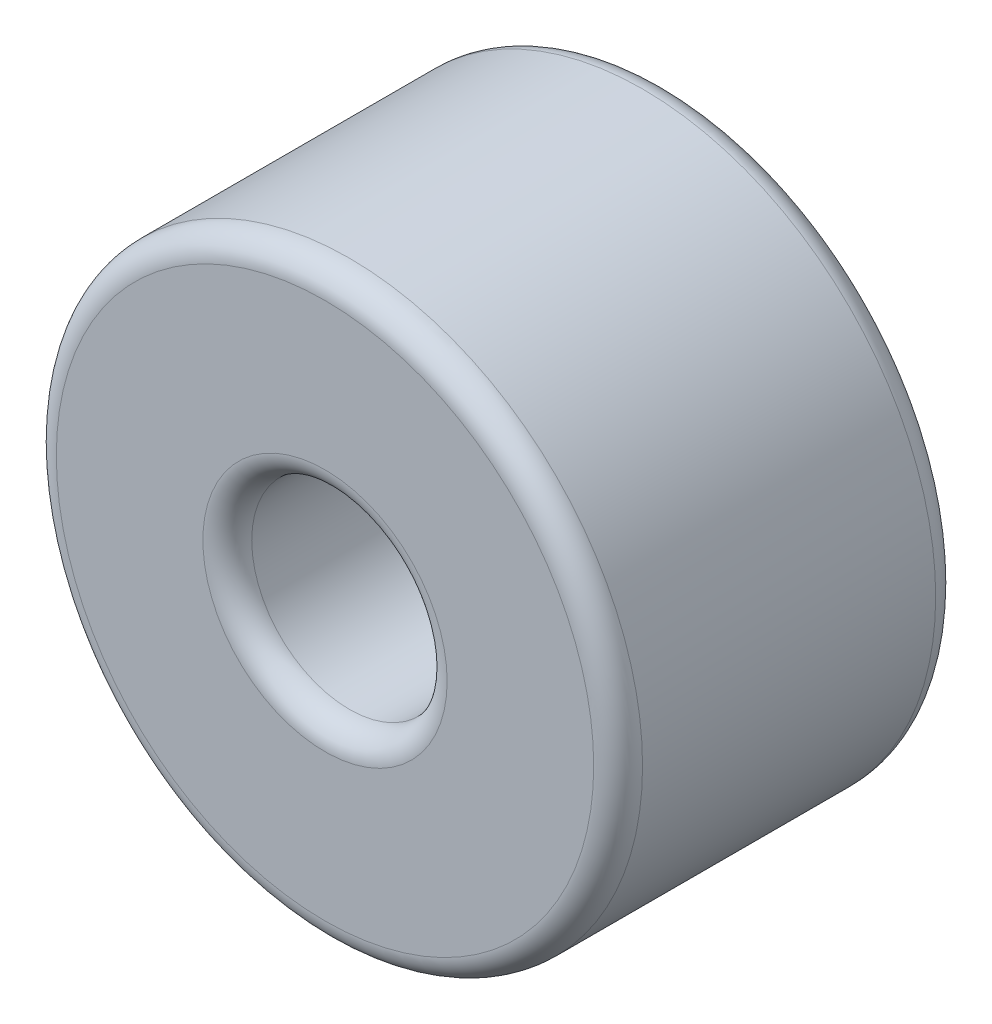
SolidWorks part; units mm, degrees
ref_plane "Ebene vorne" through (0, 0, 0) normal (0, 0, 1) x (1, 0, 0)
ref_plane "Ebene oben" through (0, 0, 0) normal (0, 1, 0) x (1, 0, 0)
ref_plane "Ebene rechts" through (0, 0, 0) normal (1, 0, 0) x (0, 0, -1)
sketch "Skizze1" plane through (0, 0, 0) normal (0, 0, 1) x (1, 0, 0)
  circle A0 centre (0, 0) radius 4
  circle A1 centre (0, 0) radius 12
  dimension "D1" = 24
  dimension "D2" = 8
extrude "Linear austragen1" add sketch "Skizze1" along normal mid plane 14
fillet "Verrundung1" radius 1 2 edges at (12, 0, -7) (12, 0, 7)
fillet "Verrundung2" radius 1 2 edges at (4, 0, -7) (4, 0, 7)
